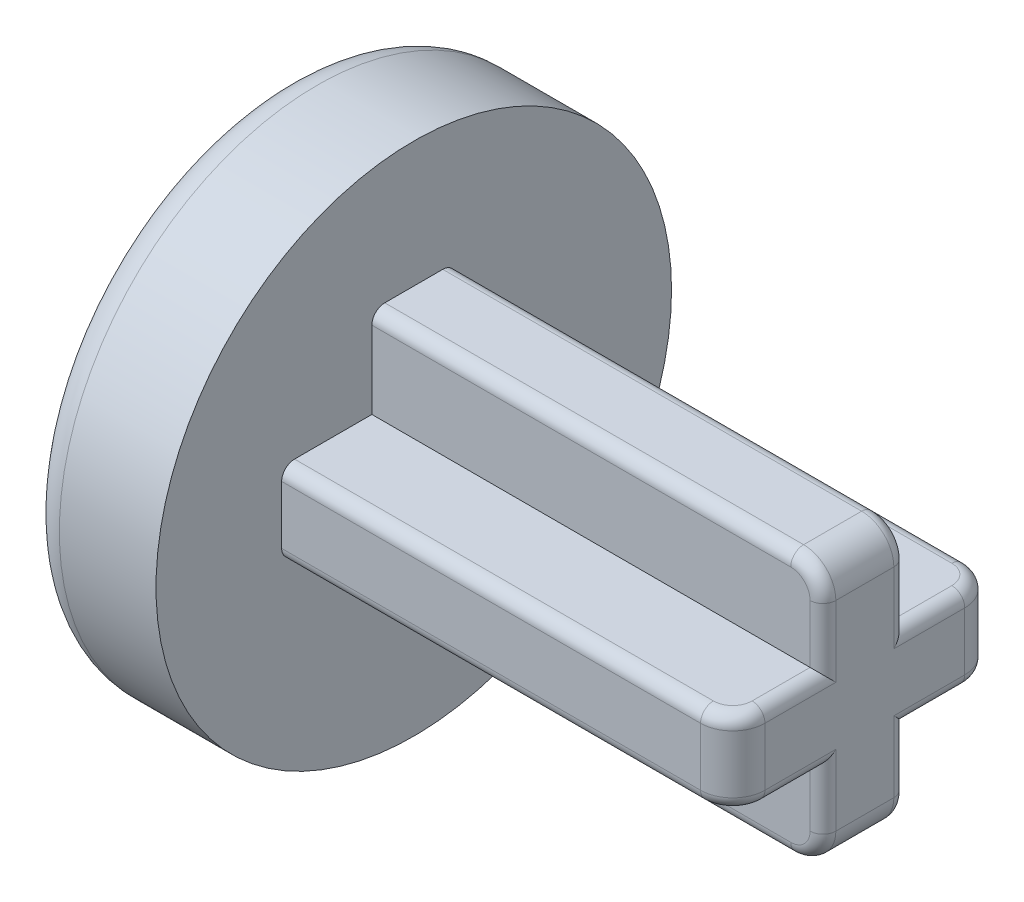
SolidWorks part; units mm, degrees
ref_plane "Front Plane" through (0, 0, 0) normal (0, 0, 1) x (1, 0, 0)
ref_plane "Top Plane" through (0, 0, 0) normal (0, 1, 0) x (1, 0, 0)
ref_plane "Right Plane" through (0, 0, 0) normal (1, 0, 0) x (0, 0, -1)
sketch "Sketch1" plane through (0, 0, 0) normal (1, 0, 0) x (0, 0, -1)
  circle A0 centre (0, 0) radius 4
  dimension "D1" = 8
extrude "body extrude" add sketch "Sketch1" along normal blind 2
sketch "Sketch3" plane through (0, 0, 0) normal (-1, 0, 0) x (0, 0, 1)
  line L0 (-1.6583, 2.5) -> (1.6583, 2.5) construction
  line L1 (0, -3) -> (0, 2.5) construction
  line L2 (-1.7321, 2.75) -> (1.7321, 2.75)
  arc A0 (-1.6583, 2.5) -> (1.6583, 2.5) centre (0, 0) ccw construction
  arc A1 (-1.7321, 2.75) -> (1.7321, 2.75) centre (0, 0) ccw
  point P1 (0, -3)
  point P2 (-1.6583, 2.5)
  point P3 (1.6583, 2.5)
  dimension "D1" = 6
  dimension "D2" = 5.5
  dimension "D3" = 0.25
extrude "motorhole" [suppressed] cut sketch "Sketch3" against normal blind 3
sketch "Sketch4" plane through (2, 0, 0) normal (1, 0, 0) x (0, 0, -1)
  line L0 (-0.9, 2.3) -> (0.9, 2.3) construction
  line L1 (0.9, 2.3) -> (0.9, 0.9) construction
  line L2 (0.9, 0.9) -> (2.3, 0.9) construction
  line L3 (2.3, 0.9) -> (2.3, -0.9) construction
  line L4 (2.3, -0.9) -> (0.9, -0.9) construction
  line L5 (0.9, -0.9) -> (0.9, -2.3) construction
  line L6 (0.9, -2.3) -> (-0.9, -2.3) construction
  line L7 (-0.9, -2.3) -> (-0.9, -0.9) construction
  line L8 (-0.9, -0.9) -> (-2.3, -0.9) construction
  line L9 (-2.3, -0.9) -> (-2.3, 0.9) construction
  line L10 (-2.3, 0.9) -> (-0.9, 0.9) construction
  line L11 (-0.9, 0.9) -> (-0.9, 2.3) construction
  line L12 (-0.65, 2.05) -> (0.65, 2.05)
  line L13 (0.65, 2.05) -> (0.65, 0.65)
  line L14 (0.65, 0.65) -> (2.05, 0.65)
  line L15 (2.05, 0.65) -> (2.05, -0.65)
  line L16 (2.05, -0.65) -> (0.65, -0.65)
  line L17 (0.65, -0.65) -> (0.65, -2.05)
  line L18 (0.65, -2.05) -> (-0.65, -2.05)
  line L19 (-0.65, -2.05) -> (-0.65, -0.65)
  line L20 (-0.65, -0.65) -> (-2.05, -0.65)
  line L21 (-2.05, -0.65) -> (-2.05, 0.65)
  line L22 (-2.05, 0.65) -> (-0.65, 0.65)
  line L23 (-0.65, 0.65) -> (-0.65, 2.05)
  dimension "D1" = 1.8
  dimension "D2" = 4.6
  dimension "D3" = 4.6
  dimension "D4" = 1.4
  dimension "D5" = 0.9
  dimension "D6" = 0.9
  dimension "D7" = 1.4
  dimension "D8" = 0.25
extrude "legoaxlehole" add sketch "Sketch4" along normal blind 7
fillet "Fillet-axle1" radius 0.2 8 edges at (5.5, -0.65, 2.05) (5.5, 0.65, 2.05) (5.5, 2.05, 0.65) (5.5, 2.05, -0.65) (5.5, 0.65, -2.05) (5.5, -0.65, -2.05) (5.5, -2.05, -0.65) (5.5, -2.05, 0.65)
fillet "Fillet-axle2" radius 0.5 4 edges at (9, 2.05, 0) (9, 0, 2.05) (9, 0, -2.05) (9, -2.05, 0)
fillet "Fillet-axle3" radius 0.2 16 edges at (9, 1.1, 0.65) (8.9743, 1.7081, 0.65) (8.9743, 1.7081, -0.65) (9, 1.1, -0.65) (8.9743, 0.65, -1.7081) (8.9743, -0.65, -1.7081) (8.9743, -1.7081, -0.65) (8.9743, -1.7081, 0.65) (8.9743, -0.65, 1.7081) (8.9743, 0.65, 1.7081) (9, 0.65, 1.1) (9, -0.65, 1.1) (9, -1.1, 0.65) (9, -1.1, -0.65) (9, -0.65, -1.1) (9, 0.65, -1.1)
sketch "Sketch7" plane through (0, 0, 0) normal (0, 1, 0) x (1, 0, 0)
  line L0 (0, 0) -> (8, 0) construction
  line L1 (8, -3.2) -> (8, 0)
  line L3 (8, 0) -> (11.2, 0)
  arc A0 (11.2, 0) -> (8, -3.2) centre (8, 0) cw
  dimension "D2" = 3.2
  dimension "D1" = 8
revolve "3D print arc" [suppressed] cut sketch "Sketch7" angle 360 about L0
fillet "3D print fillet" radius 0.5 1 edges at (0, 0, -4)
